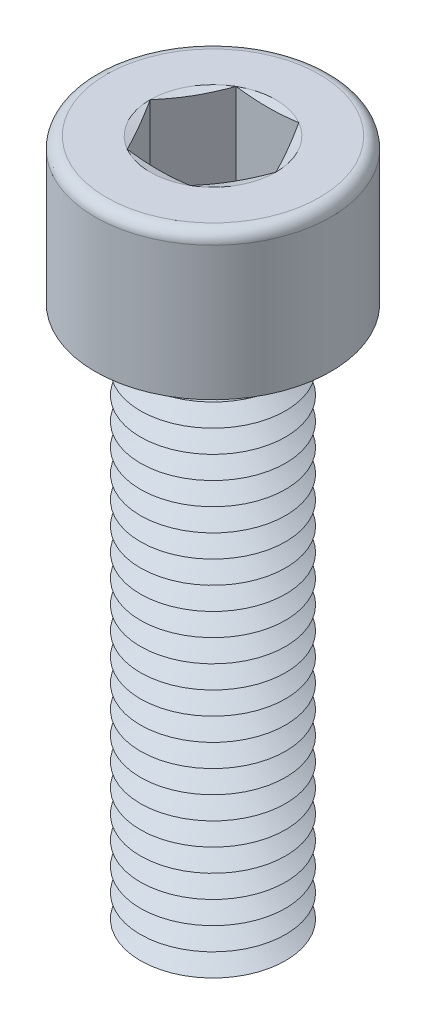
SolidWorks part; units mm, degrees
ref_plane "Front Plane" through (0, 0, 0) normal (0, 0, 1) x (1, 0, 0)
ref_plane "Top Plane" through (0, 0, 0) normal (0, 1, 0) x (1, 0, 0)
ref_plane "Right Plane" through (0, 0, 0) normal (1, 0, 0) x (0, 0, -1)
sketch "Sketch1" plane through (0, 0, 0) normal (0, 1, 0) x (1, 0, 0)
  circle A0 centre (0, 0) radius 4
  dimension "D1" = 8
extrude "Extrude1" add sketch "Sketch1" along normal blind 30
sketch "Sketch2" plane through (0, 30, 0) normal (0, 1, 0) x (1, 0, 0)
  circle A0 centre (0, 0) radius 6.5
  dimension "D1" = 13
extrude "Extrude2" add sketch "Sketch2" along normal blind 8
sketch "Sketch3" plane through (0, 38, 0) normal (0, 1, 0) x (1, 0, 0)
  line L1 (1.7321, 3) -> (-1.7321, 3)
  line L2 (-1.7321, 3) -> (-3.4641, 0)
  line L3 (-3.4641, 0) -> (-1.7321, -3)
  line L4 (-1.7321, -3) -> (1.7321, -3)
  line L5 (1.7321, -3) -> (3.4641, 0)
  line L6 (3.4641, 0) -> (1.7321, 3)
  circle A0 centre (0, 0) radius 3 construction
  dimension "D1" = 6
extrude "Extrude3" cut sketch "Sketch3" against normal blind 6
fillet "Fillet1" radius 0.625 1 edges at (0, 38, 6.5)
sketch "Sketch4" plane through (0, 0, 0) normal (1, 0, 0) x (0, 0, -1)
  line L0 (-3, 32) -> (0, 32)
  line L1 (0, 32) -> (0, 30.2679)
  line L2 (0, 30.2679) -> (-3, 32)
  dimension "D1" = 30
revolve "Cut-Revolve1" cut sketch "Sketch4" angle 360 about L1
sketch "Sketch5" plane through (0, 0, 0) normal (0, 0, 1) x (1, 0, 0)
  line L0 (-4, 0.625) -> (-4, -0.625)
  line L1 (-4, 30) -> (-4, 0) construction
  line L2 (-4, -0.625) -> (-2.9175, 0)
  line L3 (-4, 0) -> (4, 0) construction
  line L4 (-2.9175, 0) -> (-4, 0.625)
  dimension "D1" = 1.25
revolve "Cut-Revolve2" cut sketch "Sketch5" angle 360 about axis through (0, 30, 0) along (0, -1, 0)
pattern_linear "LPattern1" count 24 spacing 1.25 along (0, 1, 0) of "Cut-Revolve2"
sketch "Sketch6" plane through (0, 38, 0) normal (0, 1, 0) x (1, 0, 0)
  circle A0 centre (0, 0) radius 3.4641
extrude "Extrude4" cut sketch "Sketch6" against normal through all draft 75
